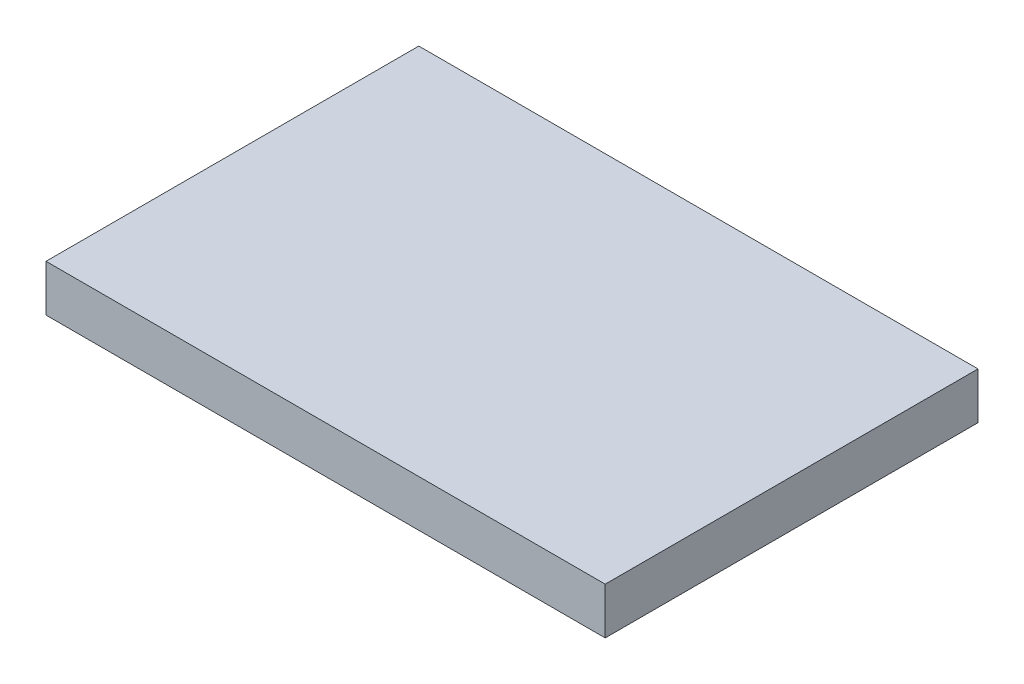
SolidWorks part; units mm, degrees
ref_plane "Front" through (0, 0, 0) normal (0, 0, 1) x (1, 0, 0)
ref_plane "Top" through (0, 0, 0) normal (0, 1, 0) x (1, 0, 0)
ref_plane "Right" through (0, 0, 0) normal (1, 0, 0) x (0, 0, -1)
sketch "Sketch1" plane through (0, 0, 0) normal (0, 0, 1) x (1, 0, 0)
  line L1 (0, 0) -> (152.4, 0)
  line L2 (0, 0) -> (0, 12.7)
  line L3 (0, 12.7) -> (152.4, 12.7)
  line L4 (152.4, 0) -> (152.4, 12.7)
  dimension "D1" = 152.4
  dimension "D2" = 12.7
extrude "Extrude1" add sketch "Sketch1" along normal blind 101.6
